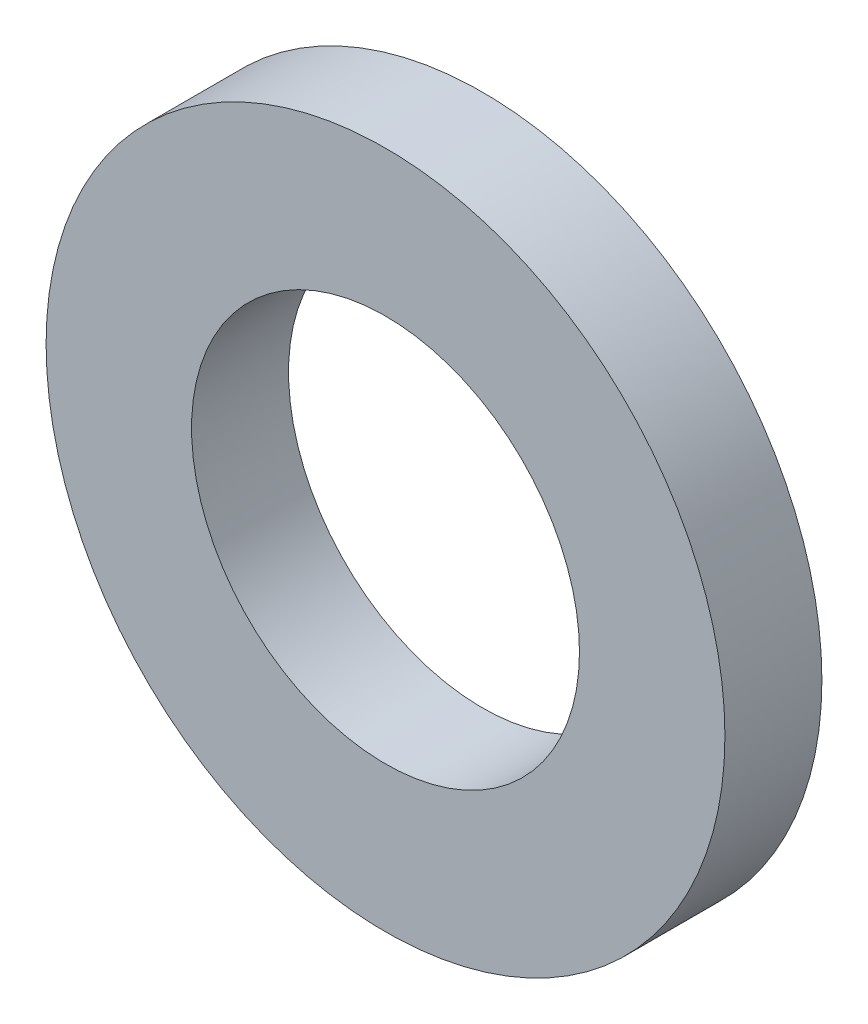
SolidWorks part; units mm, degrees
ref_plane "Front" through (0, 0, 0) normal (0, 0, 1) x (1, 0, 0)
ref_plane "Top" through (0, 0, 0) normal (0, 1, 0) x (1, 0, 0)
ref_plane "Right" through (0, 0, 0) normal (1, 0, 0) x (0, 0, -1)
sketch "Sketch1" plane through (0, 0, 0) normal (0, 0, 1) x (1, 0, 0)
  circle A0 centre (0, 0) radius 44.45
  circle A1 centre (0, 0) radius 25.4
  dimension "D1" = 50.8
  dimension "D2" = 88.9
extrude "Extrude1" add sketch "Sketch1" along normal mid plane 12.7
